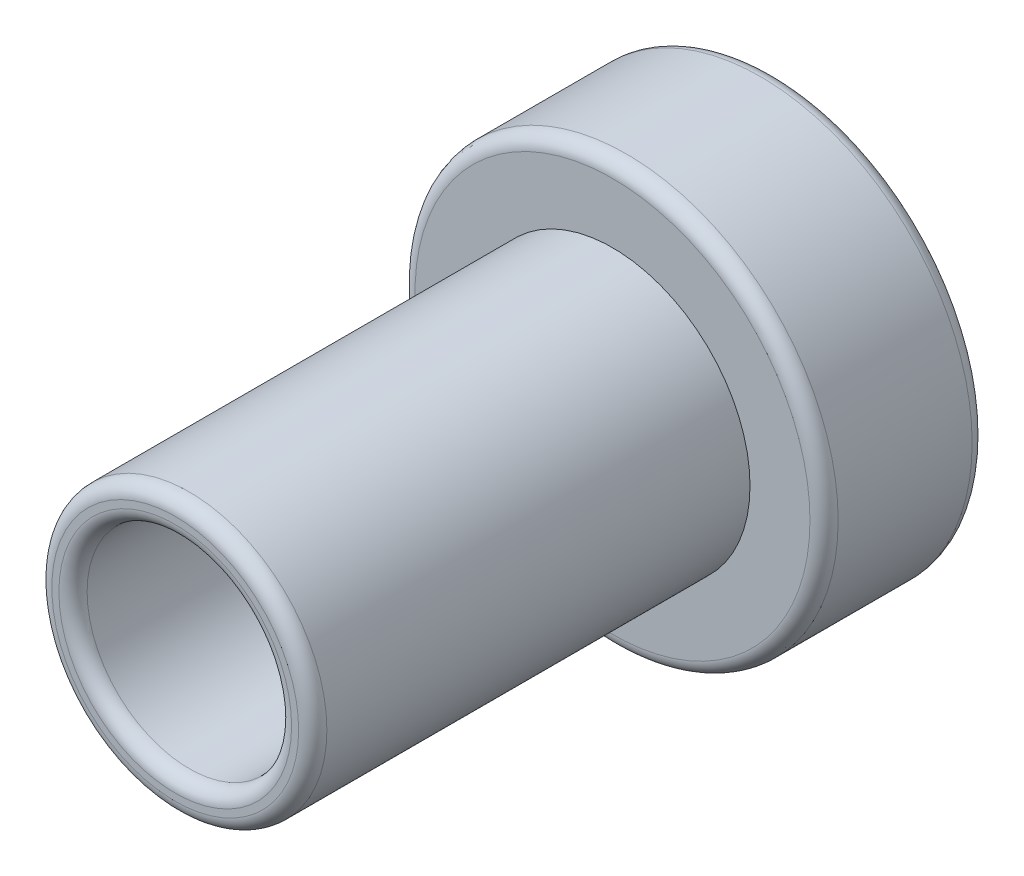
SolidWorks part; units mm, degrees
ref_plane "Plan1" through (0, 0, 0) normal (0, 0, 1) x (1, 0, 0)
ref_plane "Plan2" through (0, 0, 0) normal (0, 1, 0) x (1, 0, 0)
ref_plane "Plan3" through (0, 0, 0) normal (1, 0, 0) x (0, 0, -1)
sketch "Esquisse1" plane through (0, 0, 0) normal (0, 0, 1) x (1, 0, 0)
  circle A0 centre (0, 0) radius 3
  dimension "D1" = 6
extrude "Extrusion1" add sketch "Esquisse1" along normal blind 2.3
sketch "Esquisse2" plane through (0, 0, 2.3) normal (0, 0, 1) x (1, 0, 0)
  circle A0 centre (0, 0) radius 1.95
  circle A1 centre (0, 0) radius 3 construction
  dimension "D1" = 3.9
extrude "Extrusion2" add sketch "Esquisse2" along normal blind 6.2
sketch "Esquisse4" plane through (0, 0, 8.5) normal (0, 0, 1) x (1, 0, 0)
  circle A0 centre (0, 0) radius 1.45
extrude "Enlèv. mat.-Extru.1" cut sketch "Esquisse4" against normal through all
fillet "Congé1" radius 0.2 5 edges at (1.45, 0, 0) (1.45, 0, 8.5) (3, 0, 0) (3, 0, 2.3) (1.95, 0, 8.5)
